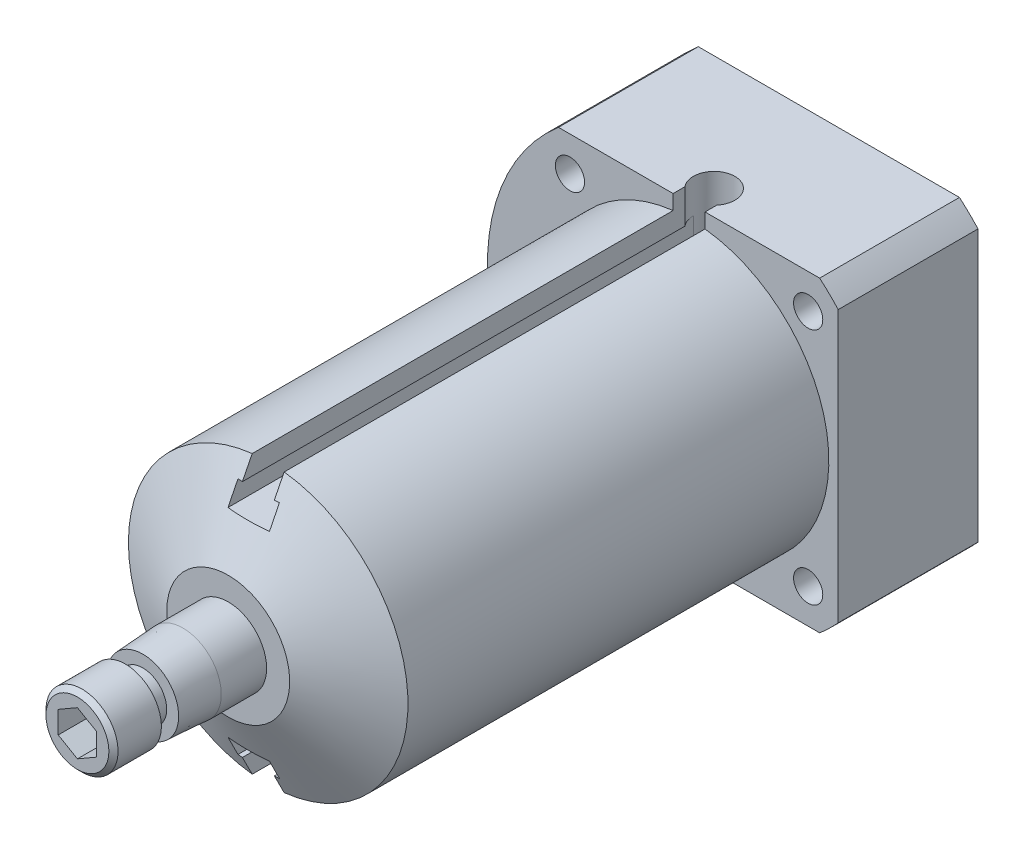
SolidWorks part; units mm, degrees
ref_plane "Front Plane" through (0, 0, 0) normal (0, 0, 1) x (1, 0, 0)
ref_plane "Top Plane" through (0, 0, 0) normal (0, 1, 0) x (1, 0, 0)
ref_plane "Right Plane" through (0, 0, 0) normal (1, 0, 0) x (0, 0, -1)
sketch "Sketch1" plane through (0, 0, 0) normal (0, 0, 1) x (1, 0, 0)
  line L0 (0, 0) -> (62.0084, 0) construction
  line L1 (-21.5923, 25.4) -> (21.5923, 25.4)
  line L2 (24.6634, 22.43) -> (24.6634, -22.43)
  line L3 (-21.5923, -25.4) -> (21.5923, -25.4)
  arc A0 (-21.5923, 25.4) -> (-21.5923, -25.4) centre (0, 0) ccw
  arc A1 (24.6634, 22.43) -> (21.5923, 25.4) centre (0, 0) ccw
  arc A2 (21.5923, -25.4) -> (24.6634, -22.43) centre (0, 0) ccw
  dimension "D1" = 66.675
  dimension "D2" = 50.8
  dimension "D3" = 24.6634
extrude "Extrude1" add sketch "Sketch1" along normal blind 99.314
sketch "Sketch2" plane through (0, 0, 0) normal (0, 1, 0) x (1, 0, 0)
  line L0 (0, 0) -> (0, -96.9332) construction
  line L1 (-33.3375, -23.114) -> (-23.114, -23.114)
  line L2 (-33.3375, 0) -> (-33.3375, -99.314) construction
  line L3 (-23.114, -23.114) -> (-23.114, -92.71)
  line L4 (-23.114, -92.71) -> (-10.16, -99.314)
  line L7 (-10.16, -99.314) -> (-33.3375, -99.314)
  line L8 (-33.3375, -99.314) -> (-33.3375, -23.114)
  dimension "D1" = 76.2
  dimension "D2" = 46.228
  dimension "D3" = 20.32
  dimension "D4" = 6.604
revolve "Cut-Revolve1" cut sketch "Sketch2" angle 360 about L0
sketch "Sketch4" plane through (0, 0, 0) normal (0, 1, 0) x (1, 0, 0)
  line L0 (0, 0) -> (0, -99.9671) construction
  line L1 (-6.3436, -99.314) -> (-6.3436, -106.807)
  line L2 (-10.16, -99.314) -> (10.16, -99.314) construction
  line L3 (-6.3436, -106.807) -> (-5.9372, -113.4516)
  line L4 (-5.9372, -113.4516) -> (0, -113.4516)
  line L7 (0, -113.4516) -> (0, -99.314)
  line L8 (0, -99.314) -> (-6.3436, -99.314)
  line L10 (-21.5923, 0) -> (-33.3375, 0) construction
  dimension "D1" = 3.5
  dimension "D4" = 12.6873
  dimension "D5" = 11.8745
  dimension "D6" = 6.6446
  dimension "D7" = 106.807
revolve "Revolve1" add sketch "Sketch4" angle 360 about L0
hole_wizard "Hole1" positions "Sketch6" profile "Sketch5" legacy
sketch "Sketch6" plane through (0, 0, 113.4516) normal (0, 0, 1) x (1, 0, 0)
  circle A0 centre (0, 0) radius 5.9372 construction
  point P0 (0, 0)
sketch "Sketch5" plane through (0, 0, 113.4516) normal (1, 0, 0) x (0, -1, 0)
  line L0 (0, 0) -> (0, 21.0111)
  line L1 (0, 21.0111) -> (3.2639, 19.05)
  line L2 (3.2639, 19.05) -> (3.2639, 0)
  line L4 (3.2639, 0) -> (0, 0)
  line L6 (0, 21.0111) -> (-3.2639, 19.05) construction
  line L7 (0, -4.2442) -> (0, 117.3081) construction
  dimension "Diameter" = 6.5278
  dimension "Depth" = 19.05
  dimension "Drill Angle" = 118
hole_wizard "Hole2" positions "Sketch10" profile "Sketch9" legacy
sketch "Sketch10" plane through (0, 0, 23.114) normal (0, 0, 1) x (1, 0, 0)
  line L1 (0, 0) -> (19.5659, 0) construction
  line L2 (0, 0) -> (19.6937, 19.6937) construction
  circle A0 centre (0, 0) radius 27.8511 construction
  point P0 (19.6937, 19.6937)
  dimension "D2" = 55.7022
  dimension "D1" = 45
sketch "Sketch9" plane through (19.6937, 19.6937, 23.114) normal (1, 0, 0) x (0, -1, 0)
  line L0 (0, 0) -> (0, 23.115)
  line L1 (0, 23.115) -> (2.413, 23.115)
  line L2 (2.413, 23.115) -> (2.413, 0)
  line L3 (2.413, 0) -> (0, 0)
  line L4 (0, 110) -> (0, -10) construction
  dimension "Diameter" = 4.826
  dimension "Depth" = 23.115
pattern_circular "CirPattern1" count 4 over 360 about axis through (0, 0, 0) along (0, 0, 1) of "Hole2"
ref_plane "Plane1" through (0, 0, 14.2748) normal (0, 0, -1) x (-1, 0, 0)
sketch "Sketch11" plane through (0, 0, 14.2748) normal (0, 0, -1) x (-1, 0, 0)
  line L0 (0, 0) -> (24.6663, 11.5021) construction
  line L1 (0, 0) -> (27.0444, 0) construction
  line L2 (64.1349, 34.5028) -> (18.0945, 13.0338)
  line L3 (18.0945, 13.0338) -> (19.8549, 9.2585)
  line L4 (19.8549, 9.2585) -> (65.8954, 30.7275)
  line L5 (65.8954, 30.7275) -> (64.1349, 34.5028)
  dimension "D1" = 25
  dimension "D2" = 21.9075
  dimension "D3" = 8.3312
  dimension "D4" = 50.8
revolve "Cut-Revolve2" cut sketch "Sketch11" angle 360 about L0
mirror "Mirror1" about plane through (0, 0, 0) normal (0, 1, 0) of "Cut-Revolve2"
sketch "Sketch12" plane through (0, 0, 99.314) normal (0, 0, 1) x (1, 0, 0)
  line L0 (0, 0) -> (0, 26.7352) construction
  line L1 (-2.6416, 50.8) -> (-2.6416, 19.7485)
  line L2 (-2.6416, 19.7485) -> (-3.429, 19.7485)
  line L3 (-3.429, 19.7485) -> (-3.429, 16.4465)
  line L4 (-3.429, 16.4465) -> (3.429, 16.4465)
  line L5 (3.429, 19.7485) -> (3.429, 16.4465)
  line L6 (2.6416, 19.7485) -> (3.429, 19.7485)
  line L7 (2.6416, 50.8) -> (2.6416, 19.7485)
  line L8 (-2.6416, 50.8) -> (2.6416, 50.8)
  dimension "D1" = 5.2832
  dimension "D2" = 6.858
  dimension "D3" = 3.302
  dimension "D4" = 16.4465
  dimension "D5" = 50.8
extrude "Cut-Extrude1" cut sketch "Sketch12" against normal blind 80.3402
sketch "Sketch13" plane through (0, 0, 99.314) normal (0, 0, 1) x (1, 0, 0)
  line L0 (0, 0) -> (32.0428, 0) construction
  line L1 (0, 0) -> (0, -27.5102) construction
  line L2 (-3.429, -16.4465) -> (3.429, -16.4465)
  line L3 (3.429, -16.4465) -> (3.429, -19.7485)
  line L4 (3.429, -19.7485) -> (2.6416, -19.7485)
  line L5 (2.6416, -19.7485) -> (2.6416, -50.8)
  line L6 (2.6416, -50.8) -> (-2.6416, -50.8)
  line L7 (-3.429, 16.4465) -> (3.429, 16.4465) construction
  line L8 (3.429, 19.7485) -> (3.429, 16.4465) construction
  line L9 (2.6416, 50.8) -> (2.6416, 19.7485) construction
  line L10 (-2.6416, -19.7485) -> (-2.6416, -50.8)
  line L11 (-3.429, -19.7485) -> (-2.6416, -19.7485)
  line L12 (-3.429, -16.4465) -> (-3.429, -19.7485)
extrude "Cut-Extrude2" cut sketch "Sketch13" against normal blind 60.325
sketch "Sketch14" plane through (0, 25.4, 0) normal (0, 1, 0) x (1, 0, 0)
  line L0 (-2.6416, -18.9738) -> (2.6416, -18.9738) construction
  circle A0 centre (0, -18.9738) radius 3.429
  dimension "D1" = 3.429
extrude "Cut-Extrude3" cut sketch "Sketch14" against normal up to surface (8.9535 mm away)
sketch "Sketch15" plane through (0, -25.4, 0) normal (0, -1, 0) x (1, 0, 0)
  line L0 (3.429, 38.989) -> (-3.429, 38.989) construction
  circle A0 centre (0, 38.989) radius 3.429
  dimension "D1" = 3.429
extrude "Cut-Extrude4" cut sketch "Sketch15" against normal up to surface (8.9535 mm away)
sketch "Sketch16" plane through (0, 0, 0) normal (0, 1, 0) x (1, 0, 0)
  line L0 (0, 0) -> (0, -122.9241) construction
  line L1 (-3.9624, -113.4516) -> (-3.9624, -116.332)
  line L2 (-5.9372, -113.4516) -> (5.9372, -113.4516) construction
  line L3 (-3.9624, -116.332) -> (-5.9563, -116.332)
  line L4 (-5.9563, -116.332) -> (-5.9563, -123.4948)
  line L5 (-5.9563, -123.4948) -> (-5.1943, -124.2568)
  line L6 (-5.1943, -124.2568) -> (0, -124.2568)
  line L7 (0, -124.2568) -> (0, -113.4516)
  line L8 (0, -113.4516) -> (-3.9624, -113.4516)
  line L9 (-6.3436, -106.807) -> (6.3436, -106.807) construction
  dimension "D1" = 7.9248
  dimension "D2" = 9.525
  dimension "D3" = 11.9126
  dimension "D4" = 7.9248
  dimension "D5" = 45
  dimension "D6" = 10.3886
revolve "Revolve2" add sketch "Sketch16" angle 360 about L0
sketch "Sketch17" plane through (0, 0, 124.2568) normal (0, 0, 1) x (1, 0, 0)
  line L1 (3.175, -1.8331) -> (3.175, 1.8331)
  line L2 (3.175, 1.8331) -> (0, 3.6662)
  line L3 (0, 3.6662) -> (-3.175, 1.8331)
  line L4 (-3.175, 1.8331) -> (-3.175, -1.8331)
  line L5 (-3.175, -1.8331) -> (0, -3.6662)
  line L6 (0, -3.6662) -> (3.175, -1.8331)
  circle A0 centre (0, 0) radius 3.175 construction
  dimension "D1" = 6.35
extrude "Cut-Extrude5" cut sketch "Sketch17" against normal blind 4.7498
